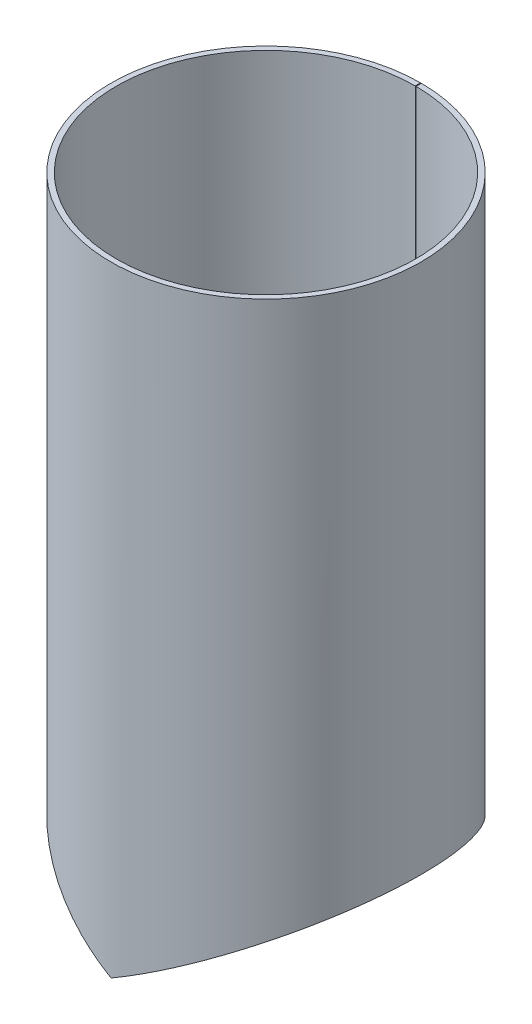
SolidWorks part; units mm, degrees
ref_plane "前视基准面" through (0, 0, 0) normal (0, 0, 1) x (1, 0, 0)
ref_plane "上视基准面" through (0, 0, 0) normal (0, 1, 0) x (1, 0, 0)
ref_plane "右视基准面" through (0, 0, 0) normal (1, 0, 0) x (0, 0, -1)
imported_body "基体零件-等角Y形管-1"
sheet metal parameters "钣金1" parameters "D1"=0.7366, "厚度"=6
bend "圆角折弯1" bend radius 169 bend angle 359.673 parameters "D5"=1
flatten bends "展开-折弯1"
sketch "尖角-草图1" plane through (0.5, 350.1443, -174.9993) normal (0.0029, 0, -1) x (-1, 0, -0.0029)
  line L0 (-530.4463, -349.8557) -> (-530.4463, 349.8557) construction
  dimension "D1" = 0
process bends "加工-折弯1" parameters "D1"=0
sketch "平面-草图1" plane through (0.5, 350.1443, -174.9993) normal (0.0029, 0, -1) x (-1, 0, -0.0029)
